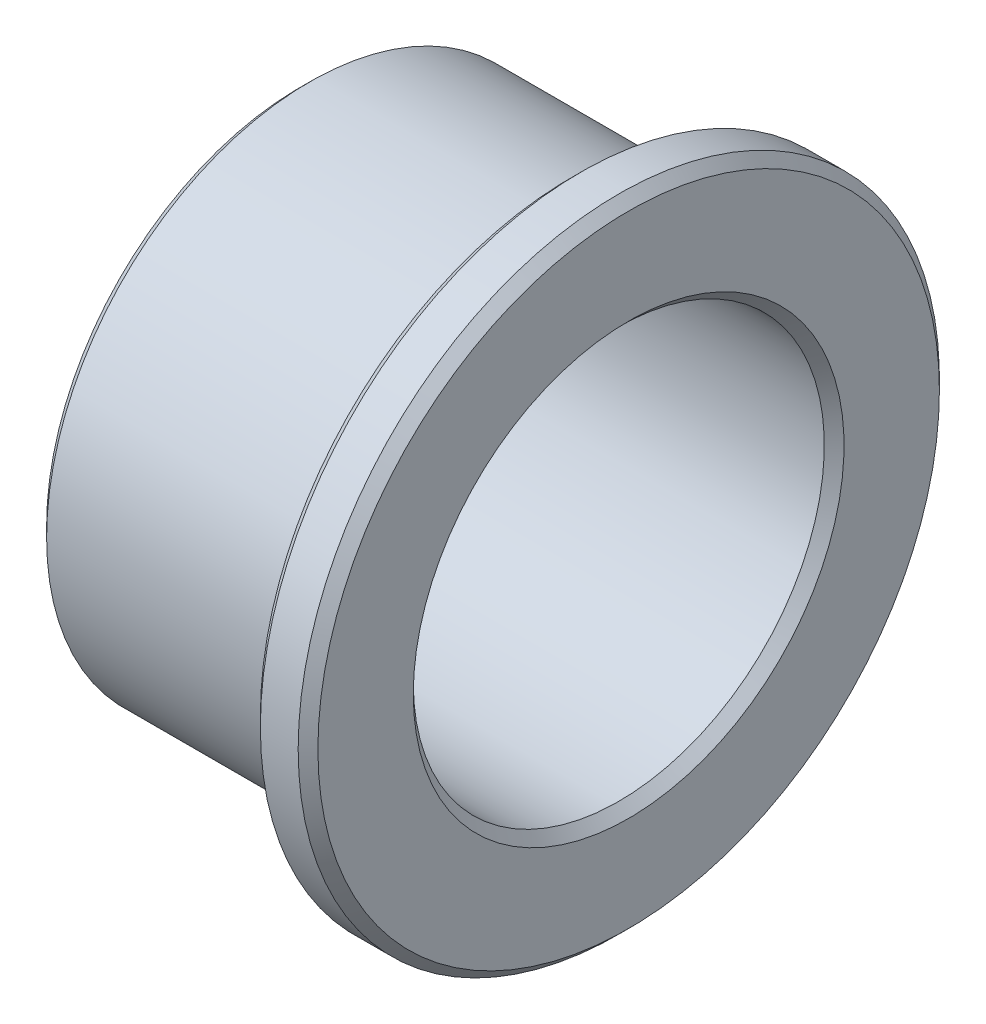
SolidWorks part; units mm, degrees
ref_plane "Plan1" through (0, 0, 0) normal (0, 0, 1) x (1, 0, 0)
ref_plane "Plan2" through (0, 0, 0) normal (0, 1, 0) x (1, 0, 0)
ref_plane "Plan3" through (0, 0, 0) normal (1, 0, 0) x (0, 0, -1)
sketch "Esquisse1" plane through (0, 0, 0) normal (0, 0, 1) x (1, 0, 0)
  line L0 (0, 13.1) -> (0, 15.4)
  line L1 (0, 15.4) -> (0.6, 16)
  line L2 (0.6, 16) -> (15.9, 16)
  line L3 (16.5, 16.6) -> (16.5, 18.9)
  line L4 (20, 18.9) -> (20, 13.1)
  line L5 (20, 13.1) -> (19.4, 12.5)
  line L6 (19.4, 12.5) -> (0.6, 12.5)
  line L7 (0.6, 12.5) -> (0, 13.1)
  line L8 (0, 0) -> (20, 0) construction
  line L9 (16.5, 18.9) -> (17.1, 19.5)
  line L10 (17.1, 19.5) -> (19.4, 19.5)
  line L11 (19.4, 19.5) -> (20, 18.9)
  arc A0 (16.5, 16.6) -> (15.9, 16) centre (15.9, 16.6) cw
  dimension "D11" = 0.6
  dimension "D1" = 12.5
  dimension "D2" = 16
  dimension "D3" = 20
  dimension "D4" = 45
  dimension "D5" = 45
  dimension "D6" = 45
  dimension "D7" = 19.5
  dimension "D8" = 3.5
  dimension "D9" = 45
  dimension "D10" = 45
revolve "Base-Révolution" add sketch "Esquisse1" angle 360 about L8
